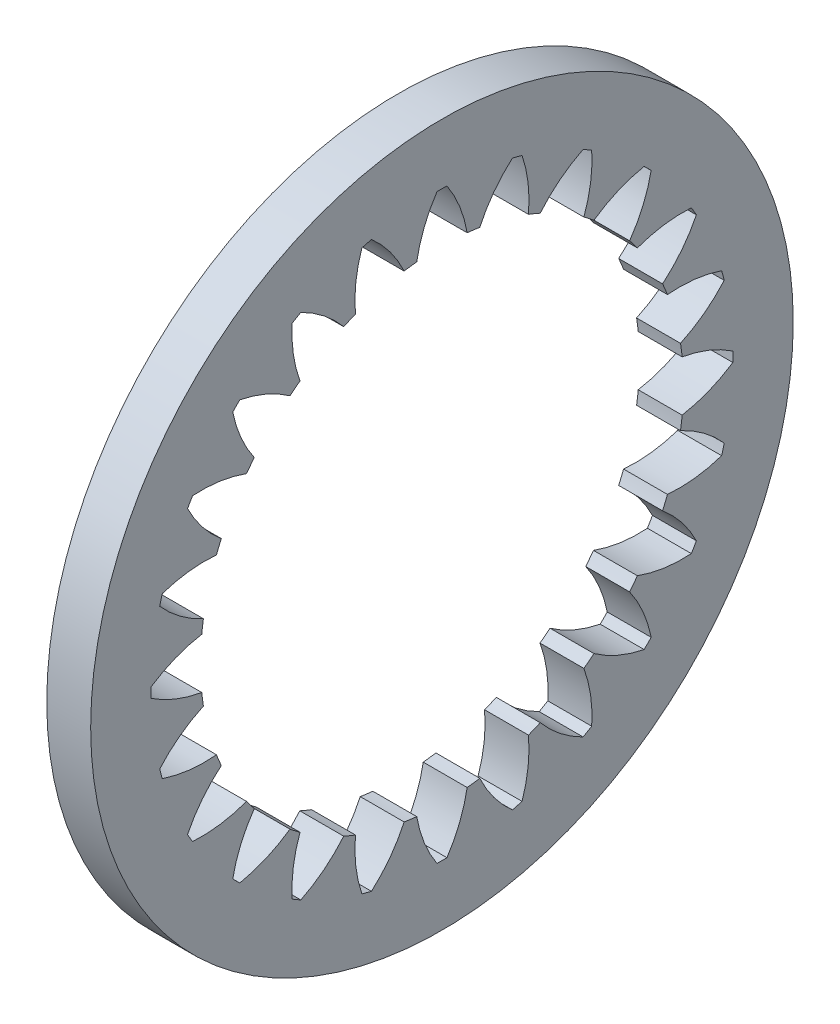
SolidWorks part; units mm, degrees
ref_plane "Plane1" through (0, 0, 0) normal (0, 0, 1) x (1, 0, 0)
ref_plane "Plane2" through (0, 0, 0) normal (0, 1, 0) x (1, 0, 0)
ref_plane "Plane3" through (0, 0, 0) normal (1, 0, 0) x (0, 0, -1)
sketch "HoldingSke" plane through (0, 0, 0) normal (0, 1, 0) x (1, 0, 0)
  line L0 (0, 0) -> (-17.6427, -100.0565)
  line L1 (-15, 0) -> (100, 0) construction
  line L2 (0, 0) -> (-2.1039, 2.3779)
  line L3 (0, 0) -> (-11.863, 4.5341)
  line L4 (0, 0) -> (7.8894, 3.5126)
  line L5 (0, 0) -> (-23.7986, -8.8762)
  line L6 (0, 0) -> (-10.5278, -7.1032)
  line L7 (-2.1039, 2.3779) -> (3.3635, 27.1825)
  line L8 (-76.2, 54.61) -> (-54.61, 54.61)
  line L9 (-67.7845, 28.3722) -> (-49.3413, 33.142)
  line L10 (-76.2, 71.12) -> (104.1128, 71.12)
  line L11 (0, 0) -> (-12.7, 0)
  line L12 (-76.2, 101.6) -> (-75.9714, 101.6)
  line L13 (24.9733, 27.94) -> (52.9518, 28.4284)
  line L14 (24.9733, 27.94) -> (24.9746, 27.94)
  line L15 (24.9733, 27.94) -> (100.4006, 29.5858)
  circle A0 centre (0, 0) radius 101.6
  circle A1 centre (0, 0) radius 12.7
  circle A2 centre (0, 0) radius 12.7
  dimension "MHD" = 25.4
  dimension "Hub_dia" = 25.4
  dimension "Diameter" = 203.2
  dimension "Num_teeth" = 24
  dimension "Pitch_radius" = 180.3128
  dimension "Pitch" = 101.6
  dimension "Width" = 12.7
  dimension "Overall_len" = 25.4
  dimension "Show_teeth" = 100
  dimension "Thickness" = 12.7
  dimension "OAL" = 25.4001
  dimension "T_dim" = 21.59
  dimension "Ap" = 14.5
  dimension "H" = 19.05
  dimension "Backlash" = 0.2286
  dimension "Addendum_fac" = 1
  dimension "Dedendum_fac" = 1.25
  dimension "Clearance_fac" = 0.25
  dimension "Dedendum_add" = 0.0013
sketch "BasProSke" plane through (0, 0, 0) normal (0, 1, 0) x (1, 0, 0)
  line L0 (-10, 0) -> (60, 0) construction
  line L1 (0, 69.85) -> (0, 101.6)
  line L2 (0, 69.85) -> (12.7, 69.85)
  line L3 (12.7, 69.85) -> (12.7, 101.6)
  line L4 (12.7, 101.6) -> (0, 101.6)
  dimension "Diameter" = 203.2
  dimension "Thickness" = 12.7
  dimension "Inside_diameter" = 139.7
revolve "Base-Revolve" add sketch "BasProSke" angle 360 about L0
sketch "TooCutSke" plane through (0, 0, 0) normal (1, 0, 0) x (0, 0, -1)
  line L3 (5.5552, 75.9972) -> (5.5552, 53.6633) construction
  line L4 (0, 0) -> (0, 59.563) construction
  line L5 (0, 0) -> (-8.9185, 67.7429) construction
  line L6 (-30.2541, 62.9855) -> (28.8527, 70.767) construction
  circle A0 centre (0, 0) radius 76.2 construction
  circle A1 centre (0, 0) radius 84.1388 construction
  circle A2 centre (0, 0) radius 66.3956 construction
  circle A3 centre (0, 0) radius 69.8246 construction
  arc A4 (7.2948, 69.4425) -> (1.4425, 84.1264) centre (-30.2541, 62.9855) ccw
  arc A5 (7.2948, 69.4425) -> (-7.2948, 69.4425) centre (0, 0) ccw
  arc A6 (1.4425, 84.1264) -> (-1.4425, 84.1264) centre (0, 0) ccw
  arc A7 (-1.4425, 84.1264) -> (-7.2948, 69.4425) centre (30.2541, 62.9855) ccw
  dimension "Pitch_dia" = 152.4
  dimension "Base_dia" = 132.7911
  dimension "Root_dia" = 168.2775
  dimension "Overcut_dia" = 139.6492
  dimension "Flank_rad" = 38.1
  dimension "Half_ang" = 7.5
  dimension "Half_CT" = 5.5552
extrude "ToothCut" cut sketch "TooCutSke" along normal through all
fillet "Breaks" [suppressed] radius 0.635
fillet "RootFillets" [suppressed] radius 1.5888
pattern_circular "TeethCuts" count 24 every 15 about axis through (-10, 0, 0) along (1, 0, 0) of "RootFillets", "Breaks", "ToothCut"
equation "' \"Pitch@HoldingSke\" = 4"
equation "' \"Num_teeth@HoldingSke\" = 24"
equation "' \"Ap@HoldingSke\" =  14.5"
equation "' \"Width@HoldingSke\" = 0.5"
equation "' \"Diameter@HoldingSke\" = 8"
equation "' \"Show_teeth@HoldingSke\" = 100"
equation "' \"Backlash@HoldingSke\" = 0.009"
equation "' \"Addendum_fac@HoldingSke\" = 1.0"
equation "' \"Dedendum_fac@HoldingSke\" = 1.25"
equation "' \"Dedendum_add@HoldingSke\" = 0.00005"
equation "' \"Clearance_fac@HoldingSke\" = 0.25"
equation "\"Overcut_dia@TooCutSke\" = (\"Num_teeth@HoldingSke\" - 2 * \"Addendum_fac@HoldingSke\") / \"Pitch@HoldingSke\" - 0.002"
equation "\"Pitch_dia@TooCutSke\" = \"Num_teeth@HoldingSke\" / \"Pitch@HoldingSke\""
equation "\"Base_dia@TooCutSke\" = \"Num_teeth@HoldingSke\" / \"Pitch@HoldingSke\" * cos((\"Ap@HoldingSke\"  * 3.14159265 / 180)) * 0.90"
equation "\"Root_dia@TooCutSke\" = \"Num_teeth@HoldingSke\"  / \"Pitch@HoldingSke\" + 2 *  \"Dedendum_fac@HoldingSke\"/ \"Pitch@HoldingSke\" + \"Dedendum_add@HoldingSke\" * 2"
equation "\"Half_ang@TooCutSke\" = 180 / \"Num_teeth@HoldingSke\""
equation "\"Half_CT@TooCutSke\" = \"Num_teeth@HoldingSke\" / \"Pitch@HoldingSke\" * sin((3.14159265 / 2 / \"Num_teeth@HoldingSke\")) / 2 + 10 * \"Backlash@HoldingSke\" / 4"
equation "\"Flank_rad@TooCutSke\" = \"Num_teeth@HoldingSke\" / \"Pitch@HoldingSke\" / 4"
equation "\"Radius@RootFillets\"= \"Clearance_fac@HoldingSke\" / \"Pitch@HoldingSke\" + \"Dedendum_add@HoldingSke\""
equation "\"Break_rad@Breaks\" = 0.02 / \"Pitch@HoldingSke\" * 5"
equation "\"Num_teeth@TeethCuts\" = int( \"Show_teeth@HoldingSke\" ) + 1"
equation "\"Num_teeth@TeethCuts\" = ((sgn( \"Num_teeth@TeethCuts\" - \"Num_teeth@HoldingSke\" )-1)*( \"Num_teeth@TeethCuts\" - \"Num_teeth@HoldingSke\" ))/-2+ \"Num_teeth@HoldingSke\""
equation "\"Num_teeth@TeethCuts\" = ((sgn( \"Num_teeth@TeethCuts\" - 2.0)+1)*( \"Num_teeth@TeethCuts\" - 2.0))/2 +2.0"
equation "\"Angle@TeethCuts\" = 360.0 / \"Num_teeth@HoldingSke\""
equation "\"Diameter@BasProSke\" = \"Num_teeth@HoldingSke\"  / \"Pitch@HoldingSke\" + 2 *  \"Dedendum_fac@HoldingSke\"/ \"Pitch@HoldingSke\" + \"Dedendum_add@HoldingSke\" * 2 + 0.002"
equation "\"Diameter@BasProSke\" = ((sgn( \"Diameter@BasProSke\"  - \"Diameter@HoldingSke\" )+1)*( \"Diameter@BasProSke\"  - \"Diameter@HoldingSke\" ))/2 + \"Diameter@HoldingSke\""
equation "\"Inside_diameter@BasProSke\" =  (\"Num_teeth@HoldingSke\" - 2 * \"Addendum_fac@HoldingSke\") / \"Pitch@HoldingSke\" "
equation "\"Thickness@BasProSke\"  = \"Width@HoldingSke\""
